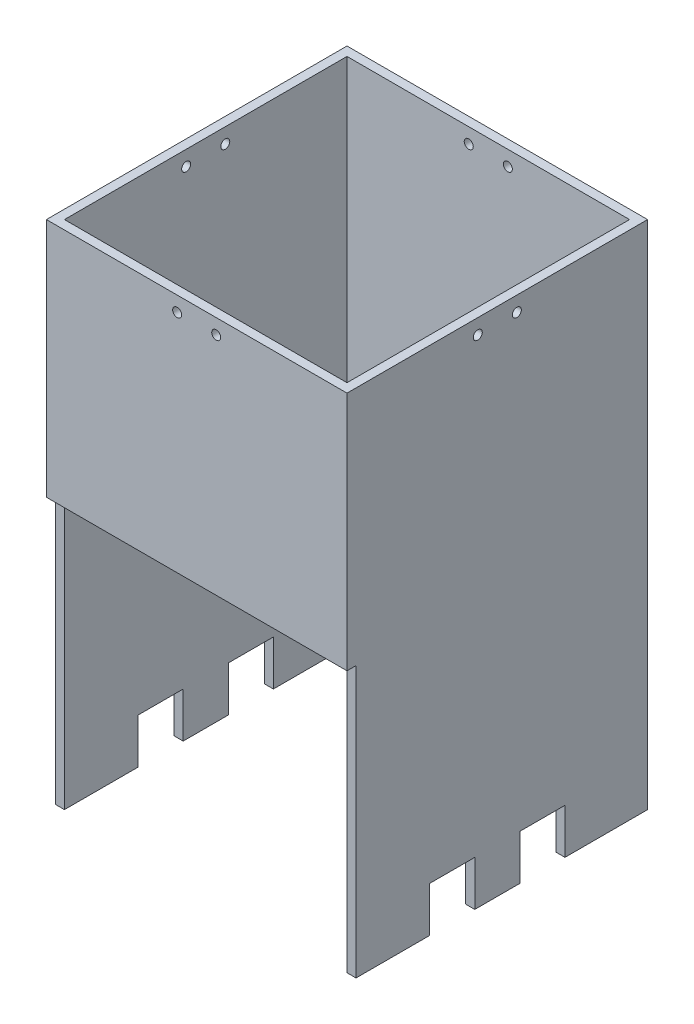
SolidWorks part; units mm, degrees
ref_plane "Front" through (0, 0, 0) normal (0, 0, 1) x (1, 0, 0)
ref_plane "Top" through (0, 0, 0) normal (0, 1, 0) x (1, 0, 0)
ref_plane "Right" through (0, 0, 0) normal (1, 0, 0) x (0, 0, -1)
sketch "草图1" plane through (0, 0, 0) normal (0, 1, 0) x (1, 0, 0)
  line L0 (-47, 47) -> (-47, -47)
  line L1 (-50, -50) -> (50, -50)
  line L2 (-50, -50) -> (-50, 50)
  line L3 (-50, 50) -> (50, 50)
  line L4 (50, -50) -> (50, 50)
  line L5 (-50, -50) -> (50, 50) construction
  line L6 (-50, 50) -> (50, -50) construction
  line L7 (-47, -47) -> (47, -47)
  line L8 (47, -47) -> (47, 47)
  line L9 (47, 47) -> (-47, 47)
  point P0 (0, 0)
  dimension "D1" = 100
  dimension "D2" = 100
  dimension "D3" = 3
extrude "凸台-拉伸1" add sketch "草图1" along normal blind 170
sketch "草图2" plane through (0, 0, 50) normal (0, 0, 1) x (1, 0, 0)
  line L1 (-50, 170) -> (50, 170) construction
  circle A0 centre (6.5, 165) radius 1.5
  circle A1 centre (-6.5, 165) radius 1.5
  point P4 (0, 170)
  dimension "D3" = 3
  dimension "D4" = 3
  dimension "D1" = 13
  dimension "D2" = 6.5
  dimension "D5" = 5
  dimension "D6" = 5
extrude "切除-拉伸1" cut sketch "草图2" against normal up to surface (100 mm away)
sketch "草图3" plane through (50, 0, 0) normal (1, 0, 0) x (0, 0, -1)
  line L1 (-50, 170) -> (50, 170) construction
  circle A0 centre (6.5, 165) radius 1.5
  circle A1 centre (-6.5, 165) radius 1.5
  point P4 (0, 170)
  dimension "D2" = 6.5
  dimension "D3" = 5
  dimension "D5" = 3
  dimension "D6" = 3
  dimension "D1" = 13
  dimension "D4" = 5
extrude "切除-拉伸2" cut sketch "草图3" against normal up to surface (100 mm away)
sketch "草图4" plane through (50, 0, 0) normal (1, 0, 0) x (0, 0, -1)
  line L0 (-50, 0) -> (50, 0) construction
  line L1 (7.5, 0) -> (22.5, 0)
  line L2 (7.5, 0) -> (7.5, 15)
  line L3 (7.5, 15) -> (22.5, 15)
  line L4 (22.5, 0) -> (22.5, 15)
  line L5 (-7.5, 0) -> (-22.5, 0)
  line L6 (-7.5, 0) -> (-7.5, 15)
  line L7 (-7.5, 15) -> (-22.5, 15)
  line L8 (-22.5, 0) -> (-22.5, 15)
  dimension "D1" = 15
  dimension "D2" = 15
  dimension "D3" = 0
  dimension "D4" = 15
  dimension "D5" = 7.5
extrude "切除-拉伸3" cut sketch "草图4" against normal up to surface (100 mm away)
sketch "草图5" plane through (50, 0, 0) normal (1, 0, 0) x (0, 0, -1)
  line L1 (-50, 170) -> (-50, 0) construction
  line L2 (-50, 0) -> (-22.5, 0) construction
  line L3 (-47, 0) -> (-50, 0)
  line L4 (-50, 0) -> (-50, 90)
  line L6 (-50, 90) -> (-47, 90)
  line L7 (-47, 90) -> (-47, 0)
  dimension "D1" = 3
  dimension "D2" = 90
  dimension "D3" = 3
extrude "切除-拉伸4" cut sketch "草图5" against normal up to surface (100 mm away)
